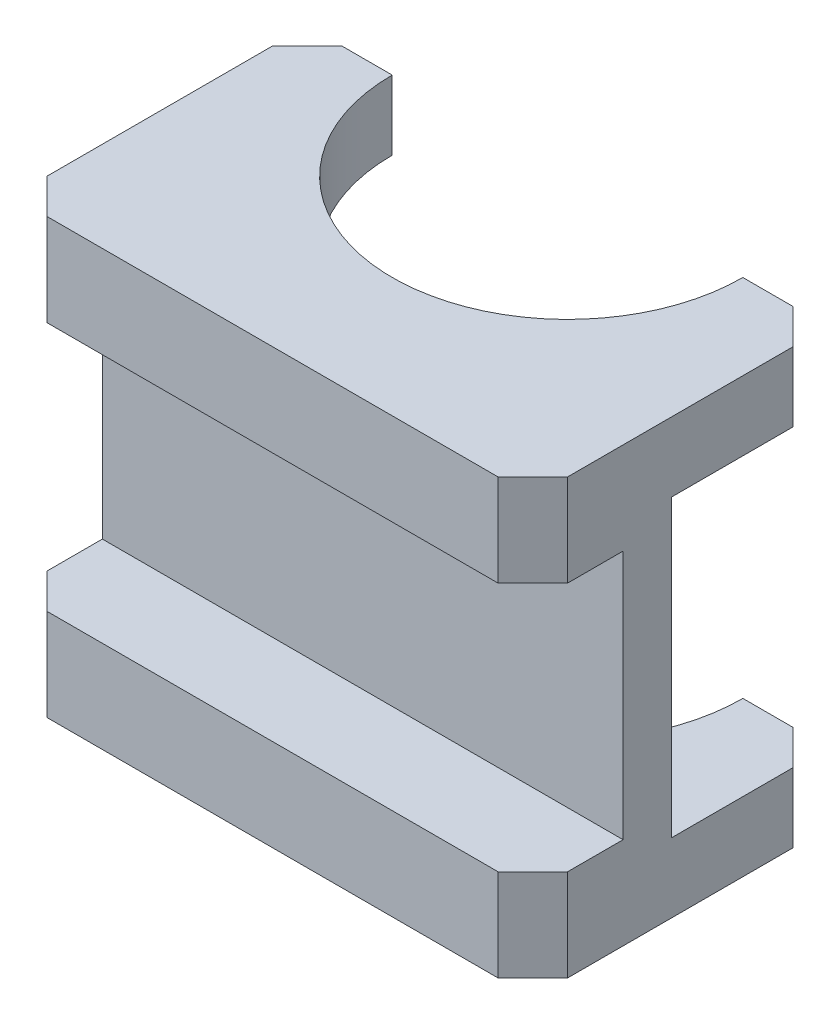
SolidWorks part; units mm, degrees
ref_plane "Front Plane" through (0, 0, 0) normal (0, 0, 1) x (1, 0, 0)
ref_plane "Top Plane" through (0, 0, 0) normal (0, 1, 0) x (1, 0, 0)
ref_plane "Right Plane" through (0, 0, 0) normal (1, 0, 0) x (0, 0, -1)
sketch "Sketch1" plane through (0, 0, 0) normal (0, 1, 0) x (1, 0, 0)
  line L1 (0, 0) -> (38.1, 0)
  line L2 (0, 0) -> (0, 21.59)
  line L3 (0, 21.59) -> (6.223, 21.59)
  line L4 (38.1, 0) -> (38.1, 21.59)
  line L5 (31.877, 21.59) -> (38.1, 21.59)
  arc A0 (6.223, 21.59) -> (31.877, 21.59) centre (19.05, 21.59) ccw
extrude "Extrude1" add sketch "Sketch1" along normal blind 31.75
sketch "Sketch2" plane through (38.1, 0, 0) normal (1, 0, 0) x (0, 0, -1)
  line L1 (0, 31.75) -> (0, 0) construction
  line L2 (0, 6.731) -> (6.604, 6.731)
  line L3 (21.59, 31.75) -> (21.59, 0) construction
  line L4 (0, 25.019) -> (6.604, 25.019)
  line L5 (6.604, 25.019) -> (6.604, 6.731)
  line L6 (0, 6.731) -> (0, 25.019)
  line L7 (21.59, 26.67) -> (10.1344, 26.67)
  line L9 (21.59, 5.08) -> (10.1344, 5.08)
  line L10 (10.1344, 5.08) -> (10.1344, 26.67)
  line L11 (21.59, 26.67) -> (21.59, 5.08)
extrude "Cut-Extrude1" cut sketch "Sketch2" against normal through all
chamfer "Chamfer1" distance 2.54 angle 45 8 edges at (0, 29.21, -21.59) (0, 2.54, -21.59) (38.1, 2.54, -21.59) (38.1, 29.21, -21.59) (38.1, 3.3655, 0) (0, 3.3655, 0) (0, 28.3845, 0) (38.1, 28.3845, 0)
